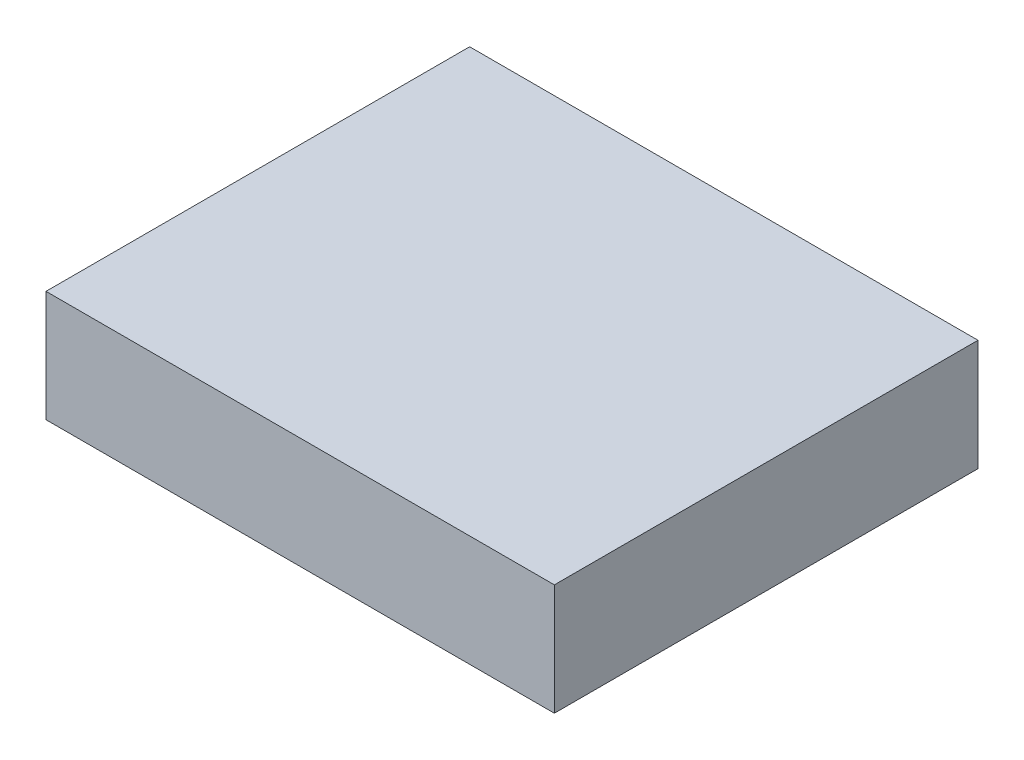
SolidWorks part; units mm, degrees
ref_plane "Front Plane" through (0, 0, 0) normal (0, 0, 1) x (1, 0, 0)
ref_plane "Top Plane" through (0, 0, 0) normal (0, 1, 0) x (1, 0, 0)
ref_plane "Right Plane" through (0, 0, 0) normal (1, 0, 0) x (0, 0, -1)
sketch "Sketch1" plane through (0, 0, 0) normal (0, 1, 0) x (1, 0, 0)
  line L1 (2.4, 2) -> (-2.4, 2)
  line L2 (2.4, 2) -> (2.4, -2)
  line L3 (2.4, -2) -> (-2.4, -2)
  line L4 (-2.4, 2) -> (-2.4, -2)
  line L5 (2.4, 2) -> (-2.4, -2) construction
  line L6 (2.4, -2) -> (-2.4, 2) construction
  point P0 (0, 0)
  dimension "D1" = 4
  dimension "D2" = 4.8
extrude "Boss-Extrude1" add sketch "Sketch1" along normal blind 1.05
